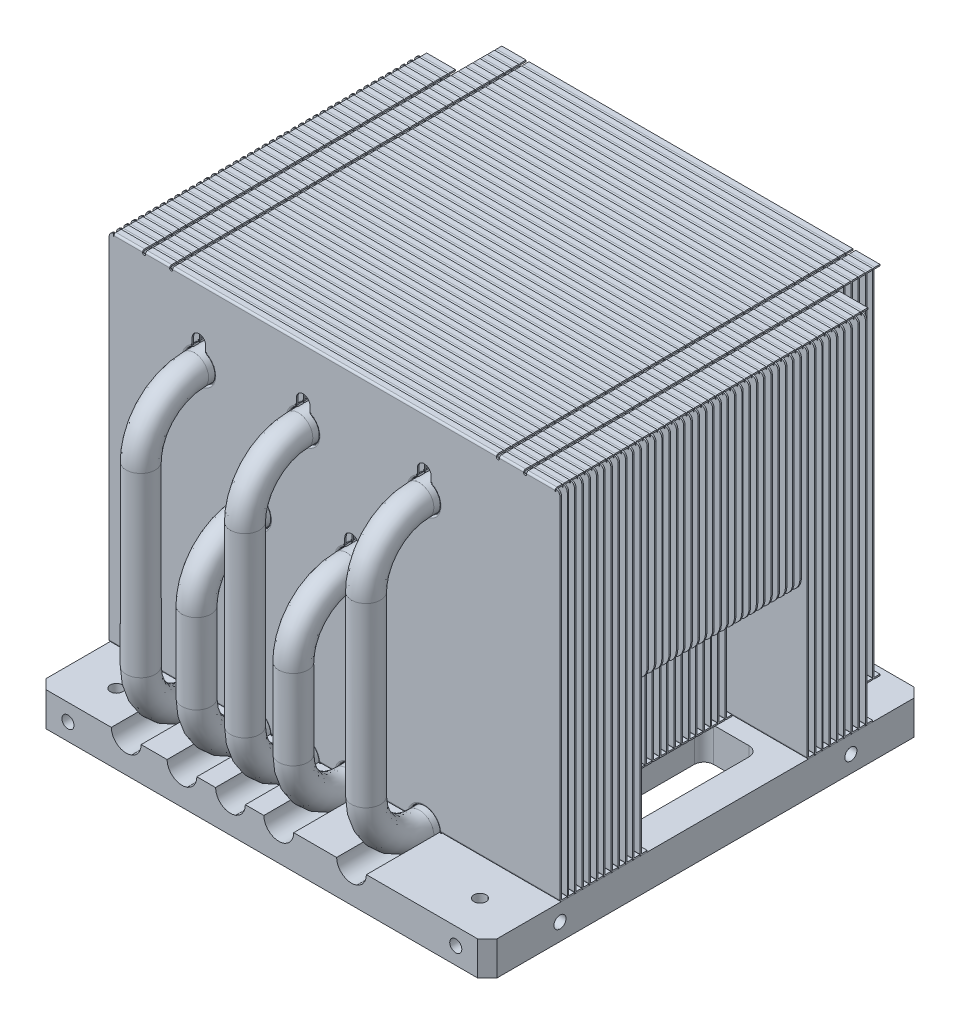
SolidWorks part; units mm, degrees
ref_plane "前视基准面" through (0, 0, 0) normal (0, 0, 1) x (1, 0, 0)
ref_plane "上视基准面" through (0, 0, 0) normal (0, 1, 0) x (1, 0, 0)
ref_plane "右视基准面" through (0, 0, 0) normal (1, 0, 0) x (0, 0, -1)
imported_body "铝鳍片1-1-solid1"
imported_body "铝鳍片1-2-solid1"
imported_body "铝鳍片1-3-solid1"
imported_body "铝鳍片1-4-solid1"
imported_body "铝鳍片1-5-solid1"
imported_body "铝鳍片1-6-solid1"
imported_body "铝鳍片1-7-solid1"
imported_body "铝鳍片1-8-solid1"
imported_body "铝鳍片1-9-solid1"
imported_body "铝鳍片1-10-solid1"
imported_body "铝鳍片1-11-solid1"
imported_body "铝鳍片1-12-solid1"
imported_body "铝鳍片2-1-solid1"
imported_body "铝鳍片2-2-solid1"
imported_body "铝鳍片2-3-solid1"
imported_body "铝鳍片2-4-solid1"
imported_body "铝鳍片2-5-solid1"
imported_body "铝鳍片2-6-solid1"
imported_body "铝鳍片2-7-solid1"
imported_body "铝鳍片2-8-solid1"
imported_body "铝鳍片2-9-solid1"
imported_body "铝鳍片2-10-solid1"
imported_body "铝鳍片2-11-solid1"
imported_body "铝鳍片2-12-solid1"
imported_body "铝鳍片2-13-solid1"
imported_body "铝鳍片2-14-solid1"
imported_body "铝鳍片2-15-solid1"
imported_body "铝鳍片2-16-solid1"
imported_body "铝鳍片2-17-solid1"
imported_body "铝鳍片2-18-solid1"
imported_body "铝鳍片2-19-solid1"
imported_body "铝鳍片2-20-solid1"
imported_body "铝鳍片2-21-solid1"
imported_body "铝鳍片2-22-solid1"
imported_body "铝鳍片1-13-solid1"
imported_body "铝鳍片1-14-solid1"
imported_body "铝鳍片1-15-solid1"
imported_body "铝鳍片1-16-solid1"
imported_body "铝鳍片1-17-solid1"
imported_body "铝鳍片1-18-solid1"
imported_body "铝鳍片1-19-solid1"
imported_body "铝鳍片1-20-solid1"
imported_body "铝鳍片1-21-solid1"
imported_body "铝鳍片3-1-solid1"
imported_body "铝鳍片3-2-solid1"
imported_body "铝鳍片3-3-solid1"
imported_body "铝鳍片3-4-solid1"
imported_body "铝鳍片3-5-solid1"
imported_body "铝鳍片3-6-solid1"
imported_body "热管1-1-solid1"
imported_body "热管1-2-solid1"
imported_body "热管1-3-solid1"
imported_body "热管2-1-solid1"
imported_body "热管2-2-solid1"
imported_body "新版D12B 4-28散热器基板-1-solid1"
sketch "草图1" plane through (0, -41.8062, 0) normal (0, -1, 0) x (1, 0, 0)
  line L1 (-42.5342, 95.464) -> (-5.1115, 95.464)
  line L2 (-42.5342, 95.464) -> (-42.5342, 38.1082)
  line L3 (-42.5342, 38.1082) -> (-5.1115, 38.1082)
  line L4 (-5.1115, 95.464) -> (-5.1115, 38.1082)
extrude "切除-拉伸1" cut sketch "草图1" against normal up to surface (0.2 mm away)
sketch "草图2" plane through (0, -37.1062, 0) normal (0, 1, 0) x (1, 0, 0)
  line L0 (24.6869, -104.75) -> (23.6869, -104.75) construction
  line L1 (24.6869, -106.4729) -> (23.6869, -106.4729)
  line L2 (24.6869, -103.0271) -> (23.6869, -103.0271)
  circle A0 centre (23.1869, -40.75) radius 0.8
  circle A1 centre (23.1869, -77.75) radius 0.8
  circle A2 centre (0.6869, -84.1922) radius 1.25
  circle A3 centre (0.6869, -90.7504) radius 0.8
  circle A4 centre (-14.0131, -89.2) radius 1.025
  circle A5 centre (-14.0131, -47.3) radius 1.025
  circle A6 centre (-24.3131, -48.75) radius 0.8
  circle A7 centre (-24.3131, -87.75) radius 0.8
  circle A8 centre (-34.6131, -89.2) radius 1.025
  circle A9 centre (-34.6131, -47.3) radius 1.025
  circle A10 centre (-49.3131, -84.1922) radius 1.25
  circle A11 centre (-49.3131, -90.7504) radius 1.5608
  circle A12 centre (-48.8131, -104.75) radius 1.525
  circle A13 centre (-54.8131, -104.75) radius 1.55
  circle A14 centre (30.1869, -104.75) radius 1.55
  circle A15 centre (30.1869, -22.75) radius 1.55
  circle A16 centre (-54.8131, -22.75) radius 1.55
  arc A17 (24.6869, -106.4729) -> (24.6869, -103.0271) centre (24.6869, -104.75) ccw
  arc A18 (23.6869, -103.0271) -> (23.6869, -106.4729) centre (23.6869, -104.75) ccw
  point P55 (24.1869, -104.75)
extrude "凸台-拉伸1" add sketch "草图2" against normal up to surface (4.5 mm away)
sketch "草图4" plane through (0, -41.6062, 0) normal (0, -1, 0) x (1, 0, 0)
  circle A0 centre (-49.3131, 84.1922) radius 1.525
  circle A1 centre (-34.6131, 89.2) radius 1.275
  circle A2 centre (-24.3131, 87.75) radius 1.025
  circle A3 centre (-14.0131, 89.2) radius 1.275
  circle A4 centre (0.6869, 90.7504) radius 1.025
  circle A5 centre (0.6869, 84.1922) radius 1.525
  circle A6 centre (23.1869, 77.75) radius 1.025
  circle A7 centre (23.1869, 40.75) radius 1.025
  circle A8 centre (-14.0131, 47.3) radius 1.275
  circle A9 centre (-24.3131, 48.75) radius 1.025
  circle A10 centre (-34.6131, 47.3) radius 1.275
extrude "凸台-拉伸2" add sketch "草图4" against normal up to surface (4.5 mm away)
sketch "草图5" plane through (0, -41.6062, 0) normal (0, -1, 0) x (1, 0, 0)
  line L0 (23.6869, 104.75) -> (24.6869, 104.75) construction
  line L1 (23.6869, 106.9651) -> (24.6869, 106.9651)
  line L2 (23.6869, 102.5349) -> (24.6869, 102.5349)
  circle A0 centre (-48.8131, 104.75) radius 2.025
  arc A1 (23.6869, 106.9651) -> (23.6869, 102.5349) centre (23.6869, 104.75) ccw
  arc A2 (24.6869, 102.5349) -> (24.6869, 106.9651) centre (24.6869, 104.75) ccw
  point P7 (24.1869, 104.75)
extrude "凸台-拉伸3" add sketch "草图5" against normal up to surface (4.5 mm away)
other "移动面1" parameters "D1"=2.5
sketch "草图18" plane through (0, 0, 18.75) normal (0, 0, -1) x (-1, 0, 0)
  line L0 (-34.1869, -40.6062) -> (58.8131, -40.6062) construction
  line L1 (-34.1869, -44.1062) -> (-34.1869, -37.1062) construction
  line L2 (58.8131, -37.1062) -> (58.8131, -44.1062) construction
  line L3 (12.3131, -44.1062) -> (12.3131, 56.8338) construction
  line L4 (-32.1869, -44.1062) -> (56.8131, -44.1062) construction
  point P10 (-27.6869, -40.6062)
  point P11 (52.3131, -40.6062)
  dimension "D1" = 80
hole_wizard "M3 螺纹孔5" positions "草图19" profile "草图20" tap size "M3" standard "GB"
sketch "草图19" plane through (0, 0, 18.75) normal (0, 0, -1) x (-1, 0, 0)
  point P0 (52.3131, -40.6062)
  point P3 (-27.6869, -40.6062)
sketch "草图20" plane through (-52.3131, -40.6062, 18.75) normal (1, 0, 0) x (0, 1, 0)
  line L0 (0, 0) -> (0, 7)
  line L1 (0, 7) -> (1.25, 7)
  line L2 (1.25, 7) -> (1.25, 0)
  line L5 (1.25, 0) -> (0, 0)
  line L10 (0, 7) -> (-1.25, 7) construction
  line L11 (0, -6.35) -> (0, 107.95) construction
  dimension "螺纹孔钻头直径" = 2.5
  dimension "螺纹孔钻头深度" = 7
  dimension "导头角度" = 180
hole_wizard "M3 螺纹孔6" positions "草图21" profile "草图22" tap size "M3" standard "GB"
sketch "草图21" plane through (0, 0, 108.75) normal (0, 0, 1) x (1, 0, 0)
  point P0 (27.6869, -40.6062)
  point P3 (-52.3131, -40.6062)
sketch "草图22" plane through (27.6869, -40.6062, 108.75) normal (1, 0, 0) x (0, -1, 0)
  line L0 (0, 0) -> (0, 7)
  line L1 (0, 7) -> (1.25, 7)
  line L2 (1.25, 7) -> (1.25, 0)
  line L5 (1.25, 0) -> (0, 0)
  line L10 (0, 7) -> (-1.25, 7) construction
  line L11 (0, -6.35) -> (0, 107.95) construction
  dimension "螺纹孔钻头直径" = 2.5
  dimension "螺纹孔钻头深度" = 7
  dimension "导头角度" = 180
sketch "草图23" plane through (0, -44.1062, 0) normal (0, -1, 0) x (1, 0, 0)
  line L0 (-12.3131, 108.75) -> (-12.3131, 18.75) construction
  line L1 (-56.8131, 108.75) -> (32.1869, 108.75) construction
  line L2 (32.1869, 18.75) -> (-56.8131, 18.75) construction
  line L3 (-58.8131, 63.75) -> (34.1869, 63.75) construction
  line L4 (-58.8131, 20.75) -> (-58.8131, 106.75) construction
  line L5 (34.1869, 106.75) -> (34.1869, 20.75) construction
  line L7 (-44.3131, 28.25) -> (19.6869, 28.25)
  line L8 (-44.3131, 28.25) -> (-44.3131, 99.25)
  line L9 (-44.3131, 99.25) -> (19.6869, 99.25)
  line L10 (19.6869, 28.25) -> (19.6869, 99.25)
  line L11 (-44.3131, 28.25) -> (19.6869, 99.25) construction
  line L12 (-44.3131, 99.25) -> (19.6869, 28.25) construction
  point P12 (-12.3131, 63.75)
  dimension "D1" = 64
  dimension "D2" = 71
extrude "切除-拉伸4" [suppressed] cut sketch "草图23" against normal blind 2.5
sketch "草图24" [suppressed] plane through (0, -41.6062, 0) normal (0, -1, 0) x (1, 0, 0)
  circle A0 centre (-12.3131, 91.25) radius 1.75
  circle A1 centre (-12.3131, 36.25) radius 1.75
  dimension "D1" = 3.5
extrude "凸台-拉伸6" [suppressed] add sketch "草图24" along normal blind 2 separate body
sketch "草图25" plane through (0, -44.1062, 0) normal (0, -1, 0) x (1, 0, 0)
  line L0 (-12.3131, 108.75) -> (-12.3131, 18.75) construction
  line L1 (-56.8131, 108.75) -> (32.1869, 108.75) construction
  line L2 (32.1869, 18.75) -> (-56.8131, 18.75) construction
  line L3 (-58.8131, 63.75) -> (34.1869, 63.75) construction
  line L4 (34.1869, 106.75) -> (34.1869, 20.75) construction
  point P10 (-49.8131, 98.75)
  point P11 (25.1869, 98.75)
  point P16 (25.1869, 28.75)
  point P17 (-49.8131, 28.75)
  dimension "D1" = 75
  dimension "D2" = 70
hole_wizard "M3 螺纹孔7" positions "草图27" profile "草图26" tap size "M3" standard "GB"
sketch "草图27" plane through (0, -44.1062, 0) normal (0, -1, 0) x (-1, 0, 0)
  point P0 (49.8131, -28.75)
  point P3 (-25.1869, -28.75)
  point P6 (-25.1869, -98.75)
  point P9 (49.8131, -98.75)
sketch "草图26" plane through (-49.8131, -44.1062, 28.75) normal (1, 0, 0) x (0, 0, -1)
  line L0 (0, 0) -> (0, 6.999)
  line L1 (0, 6.999) -> (1.25, 6.999)
  line L2 (1.25, 6.999) -> (1.25, 0)
  line L5 (1.25, 0) -> (0, 0)
  line L10 (0, 6.999) -> (-1.25, 6.999) construction
  line L11 (0, -6.35) -> (0, 107.95) construction
  dimension "螺纹孔钻头直径" = 2.5
  dimension "螺纹孔钻头深度" = 6.999
  dimension "导头角度" = 180
sketch "草图6" plane through (0, -44.1062, 0) normal (0, -1, 0) x (1, 0, 0)
  line L0 (-12.3131, 108.75) -> (-12.3131, 18.75) construction
  line L1 (-56.8131, 108.75) -> (32.1869, 108.75) construction
  line L2 (32.1869, 18.75) -> (-56.8131, 18.75) construction
  line L3 (-58.8131, 63.75) -> (34.1869, 63.75) construction
  line L4 (-58.8131, 20.75) -> (-58.8131, 106.75) construction
  line L5 (34.1869, 106.75) -> (34.1869, 20.75) construction
  line L7 (-45.3131, 27.25) -> (20.6869, 27.25)
  line L8 (-45.3131, 27.25) -> (-45.3131, 100.25)
  line L9 (-45.3131, 100.25) -> (20.6869, 100.25)
  line L10 (20.6869, 27.25) -> (20.6869, 100.25)
  line L11 (-45.3131, 27.25) -> (20.6869, 100.25) construction
  line L12 (-45.3131, 100.25) -> (20.6869, 27.25) construction
  point P12 (-12.3131, 63.75)
  dimension "D1" = 66
  dimension "D2" = 73
extrude "切除-拉伸3" [suppressed] cut sketch "草图6" against normal blind 2.5
sketch "草图7" [suppressed] plane through (0, -41.6062, 0) normal (0, -1, 0) x (1, 0, 0)
  line L0 (-12.3131, 100.25) -> (-12.3131, 27.25) construction
  line L1 (20.6869, 100.25) -> (-45.3131, 100.25) construction
  line L2 (-45.3131, 27.25) -> (20.6869, 27.25) construction
  line L3 (-45.3131, 63.75) -> (34.1869, 63.75) construction
  line L4 (-45.3131, 100.25) -> (-45.3131, 27.25) construction
  line L5 (34.1869, 106.75) -> (34.1869, 20.75) construction
  circle A0 centre (-12.3131, 91.25) radius 1.75
  circle A1 centre (-12.3131, 36.25) radius 1.75
  dimension "D1" = 3.5
  dimension "D2" = 55
extrude "凸台-拉伸5" [suppressed] add sketch "草图7" along normal blind 2.5
fillet "圆角1" [suppressed] radius 2
sketch "草图28" plane through (0, -44.1062, 0) normal (0, -1, 0) x (1, 0, 0)
  line L0 (-58.8131, 20.75) -> (-58.8131, 106.75) construction
  line L1 (-56.8131, 108.75) -> (32.1869, 108.75) construction
  point P0 (-49.8131, 101.25)
  point P1 (25.1869, 101.25)
  point P3 (25.1869, 26.25)
  point P5 (-49.8131, 26.25)
  dimension "D1" = 75
  dimension "D2" = 75
  dimension "D3" = 9
  dimension "D4" = 7.5
hole_wizard "M3x0.5 螺纹孔2" positions "草图31" profile "草图32" tap size "M3x0.5" standard "BSI"
sketch "草图31" plane through (0, -44.1062, 0) normal (0, -1, 0) x (-1, 0, 0)
  point P0 (-25.1869, -26.25)
  point P4 (-25.1869, -101.25)
  point P7 (49.8131, -101.25)
  point P10 (49.8131, -26.25)
sketch "草图32" plane through (25.1869, -44.1062, 26.25) normal (1, 0, 0) x (0, 0, -1)
  line L0 (0, 0) -> (0, 6.999)
  line L1 (0, 6.999) -> (1.25, 6.999)
  line L2 (1.25, 6.999) -> (1.25, 0)
  line L5 (1.25, 0) -> (0, 0)
  line L10 (0, 6.999) -> (-1.25, 6.999) construction
  line L11 (0, -6.35) -> (0, 107.95) construction
  dimension "螺纹孔钻头直径" = 2.5
  dimension "螺纹孔钻头深度" = 6.999
  dimension "导头角度" = 180
hole_wizard "M3 螺纹孔8" positions "草图33" profile "草图35" tap size "M3" standard "GB"
sketch "草图33" plane through (34.1869, 0, 0) normal (1, 0, 0) x (0, 0, -1)
  line L0 (-106.75, -44.1062) -> (-20.75, -44.1062) construction
  line L1 (-18.75, -37.1062) -> (-18.75, -44.1062) construction
  line L2 (-108.75, -37.1062) -> (-108.75, -44.1062) construction
  point P0 (-33.75, -40.6062)
  point P1 (-93.75, -40.6062)
  dimension "D1" = 15
  dimension "D2" = 3.5
  dimension "D3" = 15
  dimension "D4" = 3.5
sketch "草图35" plane through (34.1869, -40.6062, 33.75) normal (0, 1, 0) x (0, 0, -1)
  line L0 (0, 0) -> (0, 7.7511)
  line L1 (0, 7.7511) -> (1.25, 7)
  line L2 (1.25, 7) -> (1.25, 0)
  line L5 (1.25, 0) -> (0, 0)
  line L10 (0, 7.7511) -> (-1.25, 7) construction
  line L11 (0, -6.35) -> (0, 107.95) construction
  dimension "螺纹孔钻头直径" = 2.5
  dimension "螺纹孔钻头深度" = 7
  dimension "导头角度" = 118
hole_wizard "M3 螺纹孔9" positions "草图37" profile "草图38" tap size "M3" standard "GB"
sketch "草图37" plane through (-58.8131, 0, 0) normal (-1, 0, 0) x (0, 0, 1)
  line L0 (20.75, -44.1062) -> (106.75, -44.1062) construction
  line L1 (108.75, -44.1062) -> (108.75, -37.1062) construction
  line L2 (18.75, -44.1062) -> (18.75, -37.1062) construction
  point P0 (93.75, -40.6062)
  point P2 (33.75, -40.6062)
  dimension "D1" = 3.5
  dimension "D2" = 3.5
  dimension "D3" = 15
  dimension "D4" = 15
sketch "草图38" plane through (-58.8131, -40.6062, 93.75) normal (0, 1, 0) x (0, 0, 1)
  line L0 (0, 0) -> (0, 8.2511)
  line L1 (0, 8.2511) -> (1.25, 7.5)
  line L2 (1.25, 7.5) -> (1.25, 0)
  line L5 (1.25, 0) -> (0, 0)
  line L10 (0, 8.2511) -> (-1.25, 7.5) construction
  line L11 (0, -6.35) -> (0, 107.95) construction
  dimension "螺纹孔钻头直径" = 2.5
  dimension "螺纹孔钻头深度" = 7.5
  dimension "导头角度" = 118
